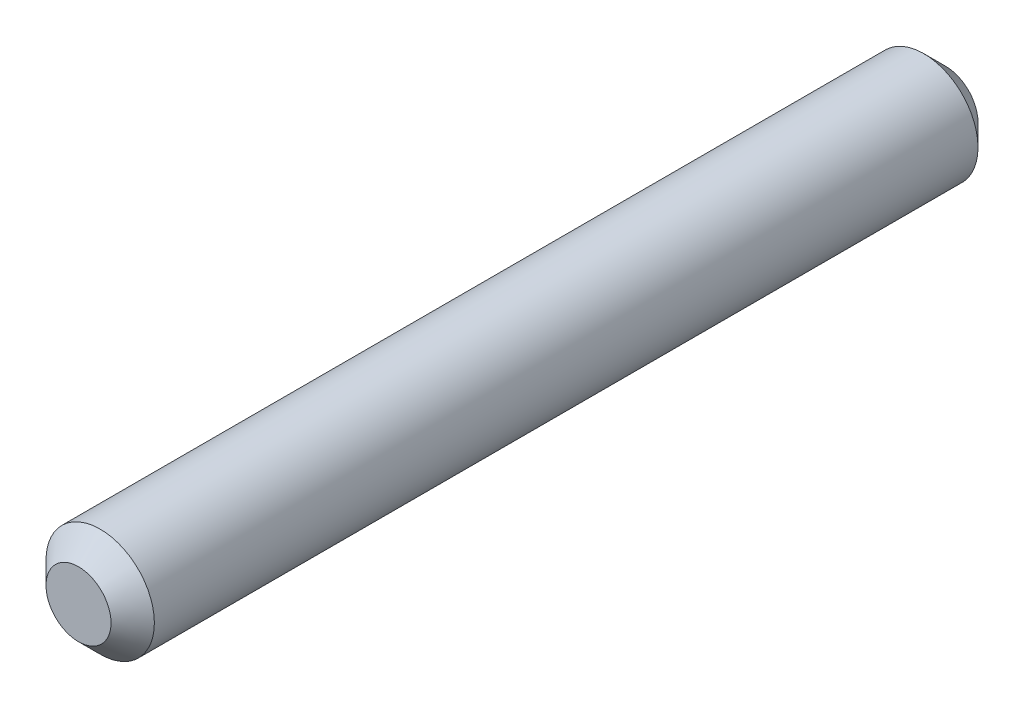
SolidWorks part; units mm, degrees
ref_plane "Front Plane" through (0, 0, 0) normal (0, 0, 1) x (1, 0, 0)
ref_plane "Top Plane" through (0, 0, 0) normal (0, 1, 0) x (1, 0, 0)
ref_plane "Right Plane" through (0, 0, 0) normal (1, 0, 0) x (0, 0, -1)
sketch "Sketch1" plane through (0, 0, 0) normal (0, 0, 1) x (1, 0, 0)
  circle A0 centre (0, 0) radius 1.5875
  dimension "D1" = 3.175
extrude "Boss-Extrude1" add sketch "Sketch1" along normal blind 25.4
chamfer "Chamfer1" distance 0.635 angle 45 2 edges at (1.5875, 0, 0) (1.5875, 0, 25.4)
